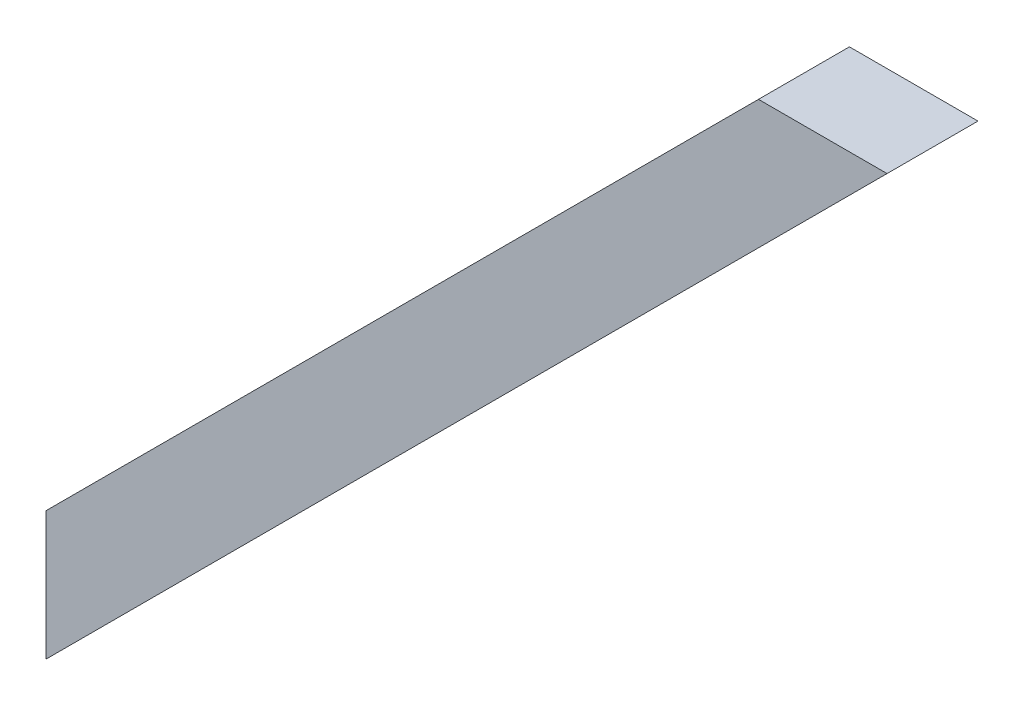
SolidWorks part; units mm, degrees
ref_plane "Plan de face" through (0, 0, 0) normal (0, 0, 1) x (1, 0, 0)
ref_plane "Plan de dessus" through (0, 0, 0) normal (0, 1, 0) x (1, 0, 0)
ref_plane "Plan de droite" through (0, 0, 0) normal (1, 0, 0) x (0, 0, -1)
sketch "Esquisse1" plane through (0, 0, 0) normal (0, 0, 1) x (1, 0, 0)
  line L0 (0, 56.5685) -> (313.4315, 370)
  line L1 (313.4315, 370) -> (370, 370)
  line L2 (370, 370) -> (0, 0)
  line L3 (0, 0) -> (0, 56.5685)
extrude "Boss.-Extru.1" add sketch "Esquisse1" against normal blind 40
